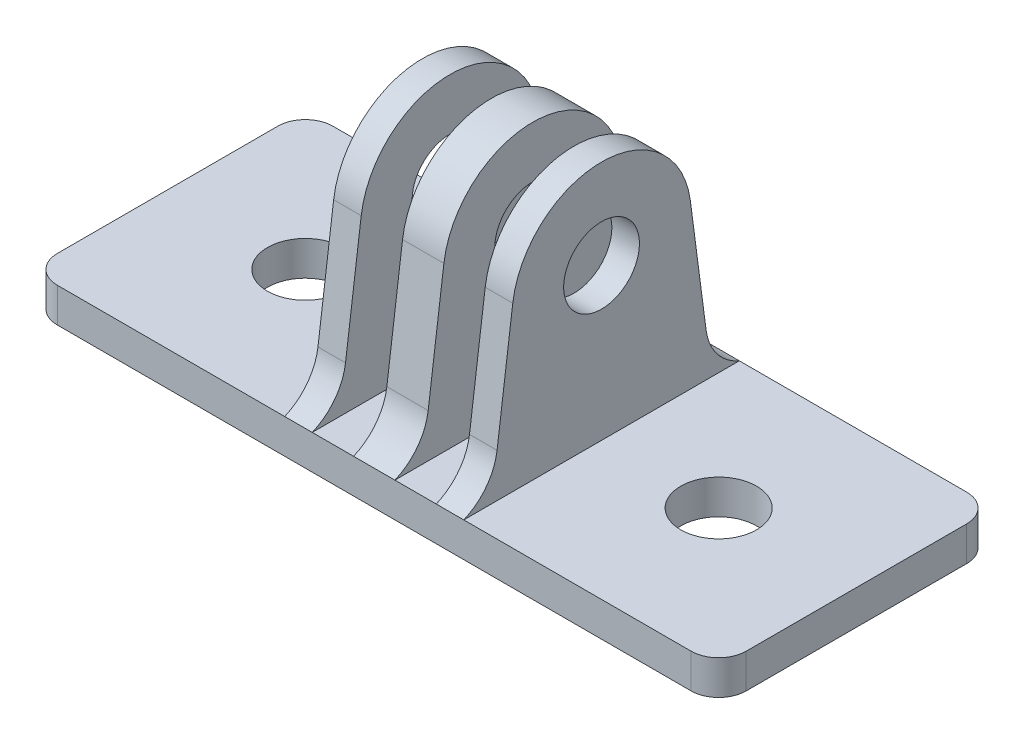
SolidWorks part; units mm, degrees
ref_plane "Plan de face" through (0, 0, 0) normal (0, 0, 1) x (1, 0, 0)
ref_plane "Plan de dessus" through (0, 0, 0) normal (0, 1, 0) x (1, 0, 0)
ref_plane "Plan de droite" through (0, 0, 0) normal (1, 0, 0) x (0, 0, -1)
sketch "Esquisse1" plane through (0, 0, 0) normal (1, 0, 0) x (0, 0, -1)
  line L0 (8, -11) -> (6.4447, 0.8461)
  line L1 (-10, -11) -> (-8, -11)
  line L2 (-10, -11) -> (-10, -13.5)
  line L3 (-10, -13.5) -> (10, -13.5)
  line L4 (10, -11) -> (10, -13.5)
  line L5 (-8, -11) -> (-6.4447, 0.8461)
  line L6 (8, -11) -> (10, -11)
  arc A0 (6.4447, 0.8461) -> (-6.4447, 0.8461) centre (0, 0) ccw
  dimension "D1" = 13
  dimension "D2" = 20
  dimension "D3" = 10
  dimension "D4" = 2.5
  dimension "D5" = 11
  dimension "D6" = 2
  dimension "D7" = 2
extrude "Extrusion1" add sketch "Esquisse1" along normal blind 50
fillet "Congé1" radius 4 2 edges at (25, -11, -8) (25, -11, 8)
sketch "Esquisse2" plane through (0, 0, 10) normal (0, 0, 1) x (1, 0, 0)
  line L0 (50, -11) -> (0, -11) construction
  line L1 (20.5, -11) -> (23.5, -11)
  line L2 (20.5, -11) -> (20.5, 8.0433)
  line L3 (20.5, 8.0433) -> (23.5, 8.0433)
  line L4 (23.5, -11) -> (23.5, 8.0433)
  line L5 (26.5, 11.5856) -> (26.5, 0) construction
  line L6 (26.5, -11) -> (29.5, -11)
  line L7 (26.5, -11) -> (26.5, 8.0433)
  line L8 (26.5, 8.0433) -> (29.5, 8.0433)
  line L9 (29.5, -11) -> (29.5, 8.0433)
  line L10 (20.5, 11.5856) -> (20.5, 0) construction
  line L11 (29.5, 8.0433) -> (55, 8.0433) construction
  line L12 (50, -11) -> (31.5, -11)
  line L13 (50, -11) -> (50, 8.0433)
  line L14 (50, 8.0433) -> (31.5, 8.0433)
  line L15 (31.5, -11) -> (31.5, 8.0433)
  line L16 (-5, 8.0433) -> (20.5, 8.0433) construction
  line L17 (0, -11) -> (18.5, -11)
  line L18 (0, -11) -> (0, 8.0433)
  line L19 (0, 8.0433) -> (18.5, 8.0433)
  line L20 (18.5, -11) -> (18.5, 8.0433)
  dimension "D1" = 2
  dimension "D2" = 2
extrude "Enlèv. mat.-Extru.1" cut sketch "Esquisse2" against normal through all
sketch "Esquisse3" plane through (31.5, 0, 0) normal (1, 0, 0) x (0, 0, -1)
  circle A0 centre (0, 0) radius 2.75
  dimension "D1" = 5.5
extrude "Enlèv. mat.-Extru.2" cut sketch "Esquisse3" against normal blind 50
sketch "Esquisse4" plane through (0, -11, 0) normal (0, 1, 0) x (-1, 0, 0)
  line L0 (-50, -10) -> (-50, 10) construction
  line L2 (-50, -10) -> (-31.5, -10) construction
  line L3 (0, -10) -> (-18.5, -10) construction
  circle A0 centre (-40, 0) radius 2.75
  circle A1 centre (-10, 0) radius 2.75
  dimension "D3" = 10
  dimension "D4" = 10
  dimension "D5" = 5.5
  dimension "D6" = 5.5
  dimension "D1" = 30
  dimension "D2" = 10
extrude "Enlèv. mat.-Extru.3" cut sketch "Esquisse4" against normal blind 50
fillet "Congé2" radius 2 4 edges at (50, -12.25, 10) (0, -12.25, 10) (0, -12.25, -10) (50, -12.25, -10)
